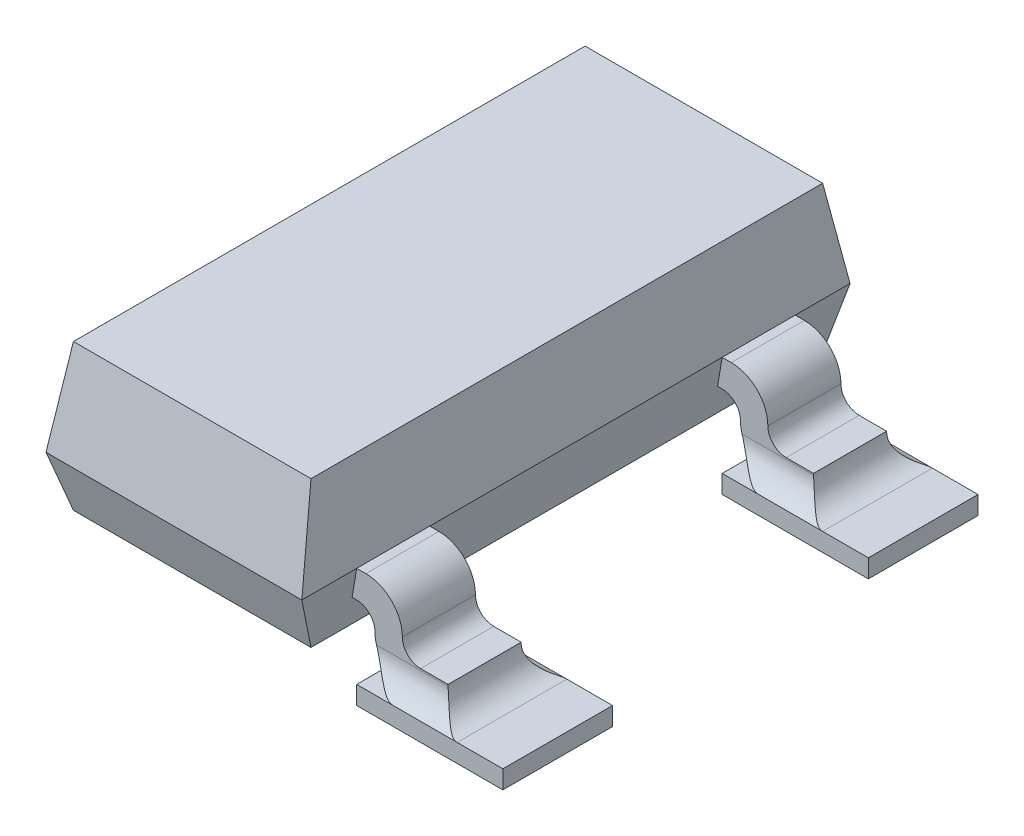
SolidWorks part; units mm, degrees
ref_plane "Plan de face" through (0, 0, 0) normal (0, 0, 1) x (1, 0, 0)
ref_plane "Plan de dessus" through (0, 0, 0) normal (0, 1, 0) x (1, 0, 0)
ref_plane "Plan de droite" through (0, 0, 0) normal (1, 0, 0) x (0, 0, -1)
sketch "Esquisse1" plane through (0, 0, 0) normal (0, 0, 1) x (1, 0, 0)
  line L0 (-0.65, -0.3) -> (0.65, -0.3)
  line L1 (0.65, -0.3) -> (0.7, 0)
  line L2 (0.7, 0) -> (0.65, 0.5)
  line L3 (0.65, 0.5) -> (-0.65, 0.5)
  line L4 (-0.65, 0.5) -> (-0.7, 0)
  line L5 (-0.7, 0) -> (-0.65, -0.3)
  line L6 (-0.7, 0) -> (0.7, 0) construction
  point P2 (0, -0.3)
  point P7 (0, 0.5)
  point P9 (0, 0)
  dimension "D1" = 1.3
  dimension "D2" = 1.4
  dimension "D3" = 1.3
  dimension "D4" = 0.3
  dimension "D5" = 0.5
extrude "Boss.-Extru.1" add sketch "Esquisse1" along normal blind 3
sketch "Esquisse2" plane through (0, 0, 0) normal (1, 0, 0) x (0, 0, -1)
  line L0 (-3, 0) -> (-2.9, 0.5)
  line L1 (-3, 0.5) -> (0, 0.5) construction
  line L2 (-2.9, 0.5) -> (-3, 0.5)
  line L3 (-3, 0.5) -> (-3, 0)
  line L4 (0, 0) -> (0, 0.5)
  line L5 (0, 0.5) -> (-0.1, 0.5)
  line L6 (-0.1, 0.5) -> (0, 0)
  dimension "D1" = 0.1
  dimension "D2" = 0.1
extrude "Enlèv. mat.-Extru.1" cut sketch "Esquisse2" against normal through all and the other way through all
sketch "Esquisse3" plane through (0, 0, 0) normal (1, 0, 0) x (0, 0, -1)
  line L0 (-3, 0) -> (-2.9, -0.3)
  line L1 (-3, -0.3) -> (0, -0.3) construction
  line L2 (-2.9, -0.3) -> (-3, -0.3)
  line L3 (-3, -0.3) -> (-3, 0)
  line L4 (0, 0) -> (-0.1, -0.3)
  line L5 (-0.1, -0.3) -> (0, -0.3)
  line L6 (0, -0.3) -> (0, 0)
  dimension "D1" = 0.1
  dimension "D2" = 0.1
extrude "Enlèv. mat.-Extru.2" cut sketch "Esquisse3" against normal through all and the other way through all
sketch "Esquisse4" plane through (0, 0, 0) normal (0, 1, 0) x (1, 0, 0)
  line L0 (0.65, -2.9) -> (0.65, -0.1) construction
  line L1 (0.65, -0.3) -> (0.95, -0.3)
  line L2 (0.65, -0.3) -> (0.65, -0.7)
  line L3 (0.65, -0.7) -> (0.95, -0.7)
  line L4 (0.95, -0.3) -> (0.95, -0.7)
  line L5 (-0.65, -2.9) -> (-0.65, -0.1) construction
  line L6 (0.65, -2.3) -> (0.95, -2.3)
  line L7 (0.65, -2.3) -> (0.65, -2.7)
  line L8 (0.65, -2.7) -> (0.95, -2.7)
  line L9 (0.95, -2.3) -> (0.95, -2.7)
  line L10 (-0.65, -1.3) -> (-0.95, -1.3)
  line L11 (-0.65, -1.3) -> (-0.65, -1.7)
  line L12 (-0.65, -1.7) -> (-0.95, -1.7)
  line L13 (-0.95, -1.3) -> (-0.95, -1.7)
  line L14 (-0.95, -1.3) -> (-0.7, 0) construction
  line L15 (-0.95, -1.7) -> (-0.7, -3) construction
  dimension "D1" = 0.4
  dimension "D2" = 0.3
  dimension "D3" = 0.3
  dimension "D4" = 0.3
extrude "Boss.-Extru.2" add sketch "Esquisse4" against normal blind 0.15
sketch "Esquisse5" plane through (0, -0.15, 0) normal (0, -1, 0) x (1, 0, 0)
  line L0 (-0.675, 1.3) -> (-0.95, 1.3) construction
  line L1 (-0.95, 1.7) -> (-0.8, 1.7)
  line L2 (-0.95, 1.7) -> (-0.95, 1.3)
  line L3 (-0.95, 1.3) -> (-0.8, 1.3)
  line L4 (-0.8, 1.7) -> (-0.8, 1.3)
  line L5 (0.95, 2.3) -> (0.675, 2.3) construction
  line L6 (0.95, 2.7) -> (0.8, 2.7)
  line L7 (0.95, 2.7) -> (0.95, 2.3)
  line L8 (0.95, 2.3) -> (0.8, 2.3)
  line L9 (0.8, 2.7) -> (0.8, 2.3)
  line L10 (0.95, 0.3) -> (0.675, 0.3) construction
  line L11 (0.95, 0.7) -> (0.8, 0.7)
  line L12 (0.95, 0.7) -> (0.95, 0.3)
  line L13 (0.95, 0.3) -> (0.8, 0.3)
  line L14 (0.8, 0.7) -> (0.8, 0.3)
  dimension "D1" = 0.15
extrude "Boss.-Extru.3" add sketch "Esquisse5" along normal blind 0.15
fillet "Congé1" radius 0.2 3 edges at (0.95, 0, 0.5) (0.95, 0, 2.5) (-0.95, 0, 1.5)
fillet "Congé2" radius 0.1 3 edges at (0.8, -0.15, 0.5) (0.8, -0.15, 2.5) (-0.8, -0.15, 1.5)
sketch "Esquisse6" plane through (0, -0.3, 0) normal (0, -1, 0) x (1, 0, 0)
  line L0 (-0.95, 1.3) -> (-0.8, 1.3) construction
  line L1 (-0.8, 1.7) -> (-1.2, 1.7)
  line L2 (-0.8, 1.7) -> (-0.8, 1.3)
  line L3 (-0.8, 1.3) -> (-1.2, 1.3)
  line L4 (-1.2, 1.7) -> (-1.2, 1.3)
  line L5 (0.8, 2.7) -> (1.2, 2.7)
  line L6 (0.8, 2.7) -> (0.8, 2.3)
  line L7 (0.8, 2.3) -> (1.2, 2.3)
  line L8 (1.2, 2.7) -> (1.2, 2.3)
  line L9 (0.8, 0.7) -> (1.2, 0.7)
  line L10 (0.8, 0.7) -> (0.8, 0.3)
  line L11 (0.8, 0.3) -> (1.2, 0.3)
  line L12 (1.2, 0.7) -> (1.2, 0.3)
  line L13 (0.8, 0.3) -> (0.95, 0.3) construction
  line L14 (0.8, 2.3) -> (0.95, 2.3) construction
  dimension "D1" = 0.4
extrude "Boss.-Extru.4" add sketch "Esquisse6" along normal blind 0.15
fillet "Congé3" radius 0.1 3 edges
fillet "Congé4" radius 0.2 3 edges at (0.8, -0.45, 0.5) (0.8, -0.45, 2.5) (-0.8, -0.45, 1.5)
sketch "Esquisse7" plane through (0, -0.45, 0) normal (0, -1, 0) x (1, 0, 0)
  line L1 (-1.6, 1.8) -> (-0.8, 1.8)
  line L2 (-1.6, 1.8) -> (-1.6, 1.2)
  line L3 (-1.6, 1.2) -> (-0.8, 1.2)
  line L4 (-0.8, 1.8) -> (-0.8, 1.2)
  line L5 (1.6, 2.8) -> (0.8, 2.8)
  line L6 (1.6, 2.8) -> (1.6, 2.2)
  line L7 (1.6, 2.2) -> (0.8, 2.2)
  line L8 (0.8, 2.8) -> (0.8, 2.2)
  line L9 (1.6, 0.8) -> (0.8, 0.8)
  line L10 (1.6, 0.8) -> (1.6, 0.2)
  line L11 (1.6, 0.2) -> (0.8, 0.2)
  line L12 (0.8, 0.8) -> (0.8, 0.2)
  line L18 (-1.2, 1.5) -> (-1.6, 1.8) construction
  line L19 (-1.2, 1.5) -> (-0.8, 1.8) construction
  line L20 (1.2, 2.5) -> (0.8, 2.8) construction
  line L21 (1.2, 2.3) -> (1.2, 2.7) construction
  line L22 (1.2, 2.5) -> (1.6, 2.8) construction
  line L23 (1.2, 0.5) -> (1.6, 0.8) construction
  line L24 (1.2, 0.3) -> (1.2, 0.7) construction
  line L25 (1.2, 0.5) -> (0.8, 0.8) construction
  line L26 (-1.2, 1.7) -> (-1.2, 1.3) construction
  line L27 (-1, 1.7) -> (-1.2, 1.7) construction
  line L28 (-1.2, 1.3) -> (-1, 1.3) construction
  line L29 (1.2, 2.7) -> (1, 2.7) construction
  line L30 (1.2, 0.7) -> (1, 0.7) construction
  point P33 (-1.2, 1.5)
  dimension "D1" = 0.8
  dimension "D2" = 0.1
  dimension "D3" = 0.1
  dimension "D4" = 0.1
  dimension "D5" = 0.1
extrude "Boss.-Extru.7" add sketch "Esquisse7" along normal blind 0.1
fillet "Congé5" radius 0.15 9 edges at (-1.1, -0.45, 1.3) (-1.1, -0.45, 1.7) (-1.2, -0.45, 1.5) (1.1, -0.45, 2.7) (1.1, -0.45, 0.7) (1.1, -0.45, 0.3) (1.2, -0.45, 0.5) (1.1, -0.45, 2.3) (1.2, -0.45, 2.5)
